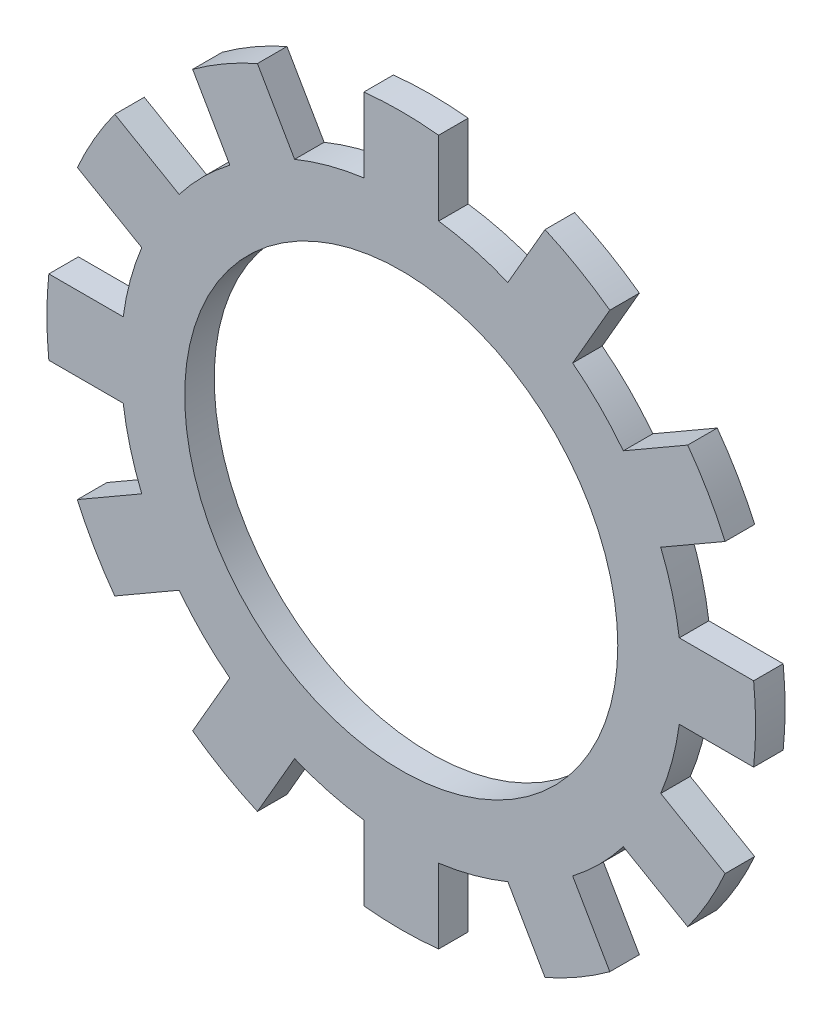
SolidWorks part; units mm, degrees
ref_plane "Front Plane" through (0, 0, 0) normal (0, 0, 1) x (1, 0, 0)
ref_plane "Top Plane" through (0, 0, 0) normal (0, 1, 0) x (1, 0, 0)
ref_plane "Right Plane" through (0, 0, 0) normal (1, 0, 0) x (0, 0, -1)
sketch "Sketch1" plane through (0, 0, 0) normal (0, 0, 1) x (1, 0, 0)
  circle A0 centre (0, 0) radius 11
  circle A1 centre (0, 0) radius 14.25
  dimension "D1" = 22
  dimension "D2" = 28.5
extrude "Boss-Extrude1" add sketch "Sketch1" along normal mid plane 1.5
sketch "Sketch2" plane through (0, 0, 0) normal (0, 0, 1) x (1, 0, 0)
  line L0 (0, 2.6811) -> (0, -2.8425) construction
sketch "Sketch3" plane through (0, 0, 0) normal (0, 0, 1) x (1, 0, 0)
  line L0 (-1.9, 17.8994) -> (-1.9, 14.1228)
  line L2 (0, 2.6811) -> (0, -2.8425) construction
  line L3 (0, 14.25) -> (0, 18)
  arc A0 (0, 18) -> (-1.9, 17.8994) centre (0, 0) ccw
  arc A1 (0, 14.25) -> (-1.9, 14.1228) centre (0, 0) ccw
  circle A2 centre (0, 0) radius 14.25 construction
  dimension "D2" = 18
  dimension "D1" = 1.9
extrude "Boss-Extrude2" add sketch "Sketch3" along normal mid plane 1.5
mirror "Mirror1" about plane through (0, 0, 0) normal (1, 0, 0) of "Boss-Extrude2"
pattern_circular "CirPattern2" count 12 over 360 about axis through (0, 0, 0) along (0, 0, 1) of "Boss-Extrude2", "Mirror1"
